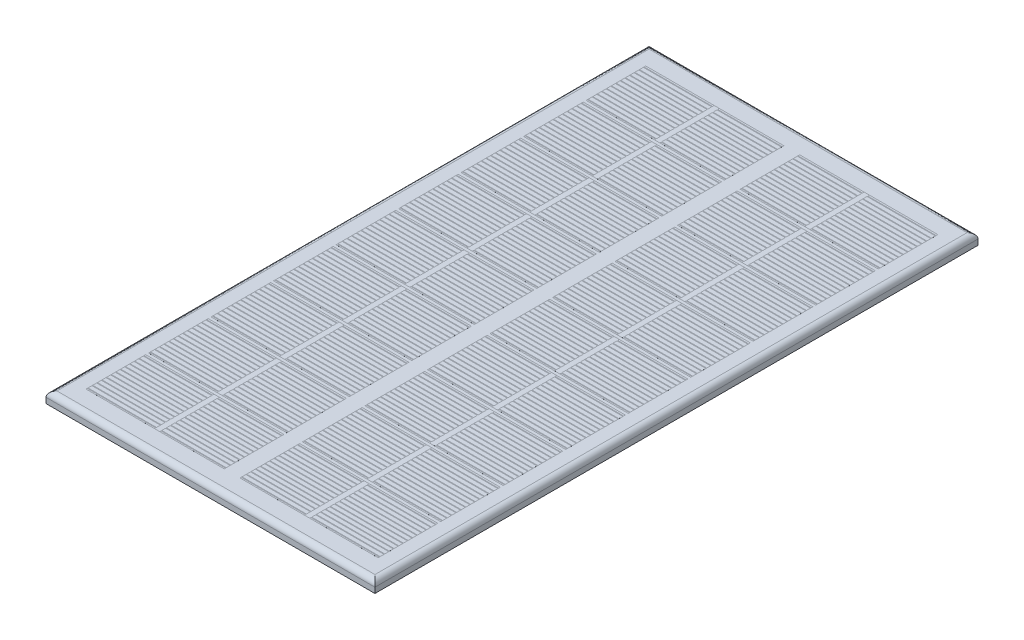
SolidWorks part; units mm, degrees
ref_plane "Front Plane" through (0, 0, 0) normal (0, 0, 1) x (1, 0, 0)
ref_plane "Top Plane" through (0, 0, 0) normal (0, 1, 0) x (1, 0, 0)
ref_plane "Right Plane" through (0, 0, 0) normal (1, 0, 0) x (0, 0, -1)
imported_body "9V Solar Cell 125mmx195mm v3.step<1>"
scale "Scale1"
fillet "Fillet1" radius 1 4 edges at (-28.4984, 2.999, 136.5377) (1.5016, 2.999, 81.5377) (-58.4984, 2.999, 81.5377) (-28.4984, 2.999, 26.5377)
